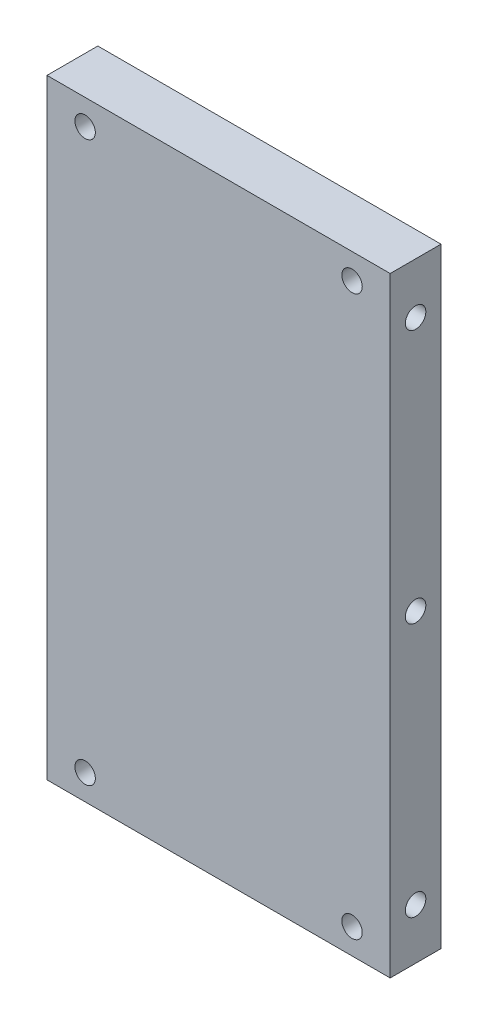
SolidWorks part; units mm, degrees
ref_plane "Front Plane" through (0, 0, 0) normal (0, 0, 1) x (1, 0, 0)
ref_plane "Top Plane" through (0, 0, 0) normal (0, 1, 0) x (1, 0, 0)
ref_plane "Right Plane" through (0, 0, 0) normal (1, 0, 0) x (0, 0, -1)
sketch "Sketch1" plane through (0, 0, 0) normal (0, 0, 1) x (1, 0, 0)
  line L1 (0, 0) -> (85.725, 0)
  line L2 (0, 0) -> (0, 152.4)
  line L3 (0, 152.4) -> (85.725, 152.4)
  line L4 (85.725, 0) -> (85.725, 152.4)
  dimension "D1" = 152.4
  dimension "D2" = 85.725
extrude "Extrude1" add sketch "Sketch1" along normal blind 12.7
hole_wizard "1/4-20 Tapped Hole1" positions "3DSketch1" profile "Sketch3" tap size "1/4-20" standard "Ansi Inch"
sketch3d "3DSketch1"
  line L4 (0, 152.4, 12.7) -> (0, 0, 12.7) construction
  line L5 (85.725, 152.4, 12.7) -> (0, 152.4, 12.7) construction
  line L6 (85.725, 0, 12.7) -> (85.725, 152.4, 12.7) construction
  line L7 (0, 0, 12.7) -> (85.725, 0, 12.7) construction
  point P28 (9.525, 6.35, 12.7)
  point P30 (76.2, 6.35, 12.7)
  point P37 (9.525, 146.05, 12.7)
  point P39 (76.2, 146.05, 12.7)
  dimension "D1" = 9.525
  dimension "D2" = 6.35
  dimension "D7" = 6.35
  dimension "D3" = 6.35
  dimension "D4" = 9.525
  dimension "D5" = 9.525
  dimension "D6" = 9.525
sketch "Sketch3" plane through (9.525, 6.35, 12.7) normal (1, 0, 0) x (0, -1, 0)
  line L0 (0, 0) -> (0, 12.7)
  line L1 (0, 12.7) -> (2.5527, 12.7)
  line L2 (2.5527, 12.7) -> (2.5527, 0)
  line L5 (2.5527, 0) -> (0, 0)
  line L11 (0, -6.35) -> (0, 107.95) construction
  dimension "Thru Tap Drill Dia." = 5.1054
  dimension "Thru Tap Drill Depth" = 12.7
hole_wizard "1/4-20 Tapped Hole2" positions "3DSketch2" profile "Sketch4" tap size "1/4-20" standard "Ansi Inch"
sketch3d "3DSketch2"
  line L0 (0, 152.4, 12.7) -> (0, 152.4, 0) construction
  line L1 (0, 152.4, 0) -> (0, 0, 0) construction
  point P0 (0, 139.7, 6.35)
  point P2 (0, 76.2, 6.35)
  point P4 (0, 12.7, 6.35)
  dimension "D1" = 63.5
  dimension "D2" = 12.7
  dimension "D3" = 139.7
  dimension "D4" = 6.35
sketch "Sketch4" plane through (0, 139.7, 6.35) normal (0, 1, 0) x (0, 0, 1)
  line L0 (0, 0) -> (0, 23.1238)
  line L1 (0, 23.1238) -> (2.5527, 21.59)
  line L2 (2.5527, 21.59) -> (2.5527, 0)
  line L5 (2.5527, 0) -> (0, 0)
  line L10 (0, 23.1238) -> (-2.5527, 21.59) construction
  line L11 (0, -6.35) -> (0, 107.95) construction
  dimension "Tap Drill Dia." = 5.1054
  dimension "Tap Drill Depth" = 21.59
  dimension "Drill Angle" = 118
ref_plane "Plane1" through (42.8625, 0, 0) normal (1, 0, 0) x (0, 0, -1)
mirror "Mirror1" about plane through (42.8625, 0, 0) normal (1, 0, 0) of "1/4-20 Tapped Hole2"
